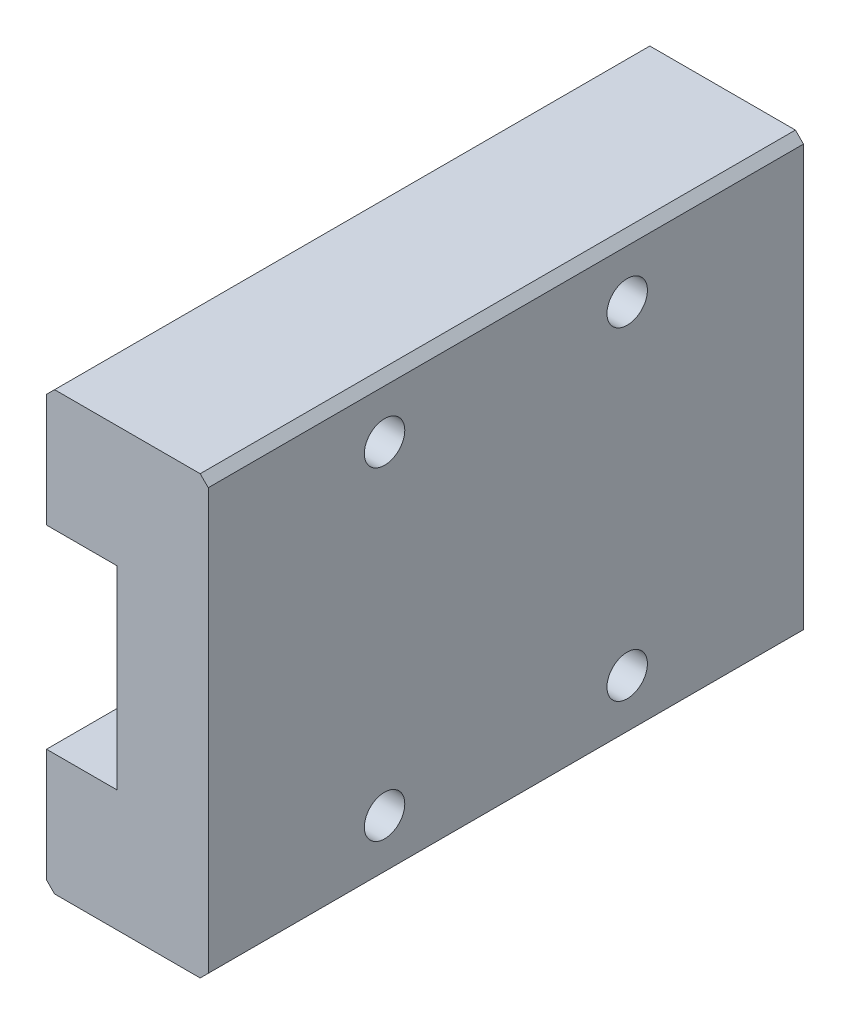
SolidWorks part; units mm, degrees
ref_plane "前视基准面" through (0, 0, 0) normal (0, 0, 1) x (1, 0, 0)
ref_plane "上视基准面" through (0, 0, 0) normal (0, 1, 0) x (1, 0, 0)
ref_plane "右视基准面" through (0, 0, 0) normal (1, 0, 0) x (0, 0, -1)
sketch "草图1" plane through (0, 0, 0) normal (0, 0, 1) x (1, 0, 0)
  line L0 (0.5, 0) -> (0, 0.5)
  line L1 (10, 0.5) -> (9.5, 0)
  line L2 (10, 26.5) -> (9.5, 27)
  line L3 (0, 26.5) -> (0.5, 27)
  line L4 (0, 7.5) -> (0, 0.5)
  line L5 (0, 26.5) -> (0, 19.5)
  line L6 (4.35, 19.5) -> (4.35, 7.5)
  line L7 (0.5, 27) -> (9.5, 27)
  line L8 (0.5, 0) -> (9.5, 0)
  line L9 (10, 26.5) -> (10, 0.5)
  line L11 (0, 19.5) -> (4.35, 19.5)
  line L12 (0, 7.5) -> (4.35, 7.5)
extrude "凸台-拉伸1" add sketch "草图1" along normal blind 36.8
sketch "草图2" plane through (10, 0, 0) normal (1, 0, 0) x (0, 0, -1)
  circle A0 centre (-25.9, 23.5) radius 1.25
  circle A1 centre (-25.9, 3.5) radius 1.25
  circle A2 centre (-10.9, 3.5) radius 1.25
  circle A3 centre (-10.9, 23.5) radius 1.25
extrude "切除-拉伸1" cut sketch "草图2" against normal blind 12
